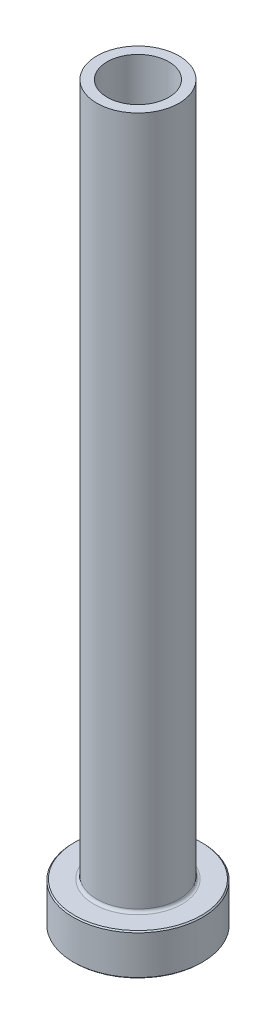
SolidWorks part; units mm, degrees
ref_plane "Front Plane" through (0, 0, 0) normal (0, 0, 1) x (1, 0, 0)
ref_plane "Top Plane" through (0, 0, 0) normal (0, 1, 0) x (1, 0, 0)
ref_plane "Right Plane" through (0, 0, 0) normal (1, 0, 0) x (0, 0, -1)
sketch "Sketch1" plane through (0, 0, 0) normal (0, 0, 1) x (1, 0, 0)
  line L0 (-5.25, 125) -> (-7, 125)
  line L1 (-7, 125) -> (-7, 7)
  line L2 (-7, 7) -> (-11, 7)
  line L3 (-11, 7) -> (-11, 0)
  line L4 (12.1, 0) -> (-12.1, 0) construction
  line L5 (-11, 0) -> (-5.5, 0)
  line L6 (-5.25, 70) -> (-5.25, 125)
  line L7 (0, 92.1877) -> (0, -15.5353) construction
  line L8 (0, -12.1) -> (0, 12.1) construction
  line L9 (-5.25, 70) -> (-5.5, 58)
  line L10 (-5.5, 58) -> (-5.5, 0)
  dimension "D1" = 0.25
  dimension "ID" = 10.5
  dimension "OD" = 14
  dimension "L" = 125
  dimension "H" = 22
  dimension "T" = 7
  dimension "N" = 55
  dimension "D2" = 12
revolve "Revolve1" add sketch "Sketch1" angle 360 about L7
fillet "Fillet1" radius 0.5 1 edges at (0, 7, 7)
chamfer "Chamfer1" distance 0.2 angle 45 2 edges at (0, 7, 11) (0, 0, 11)
chamfer "Chamfer3" distance 0.5 angle 45 1 edges at (0, 0, 5.5)
